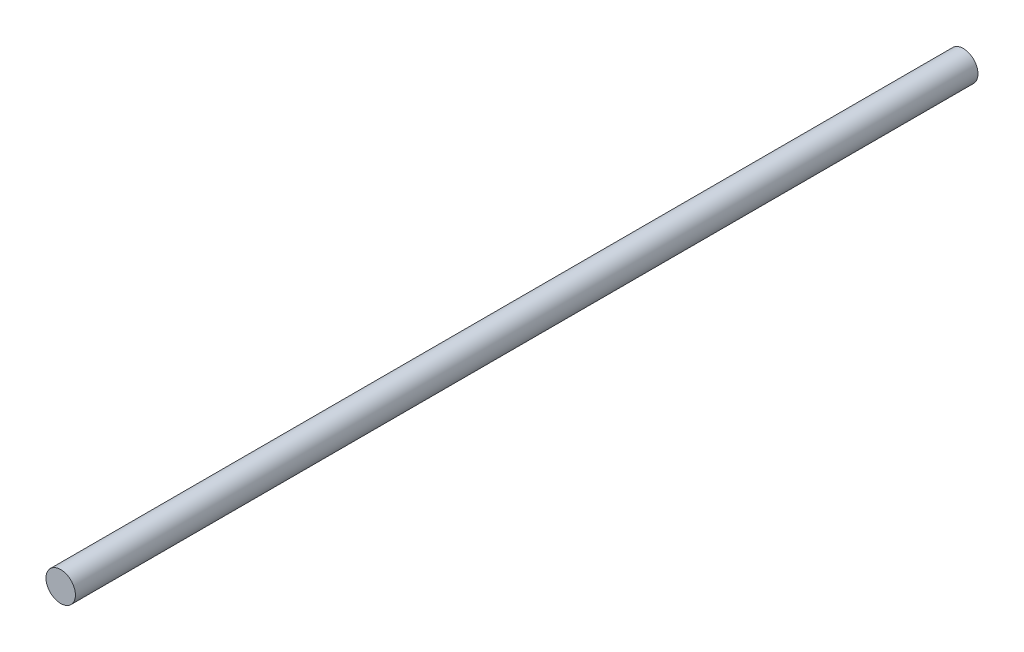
SolidWorks part; units mm, degrees
ref_plane "Front Plane" through (0, 0, 0) normal (0, 0, 1) x (1, 0, 0)
ref_plane "Top Plane" through (0, 0, 0) normal (0, 1, 0) x (1, 0, 0)
ref_plane "Right Plane" through (0, 0, 0) normal (1, 0, 0) x (0, 0, -1)
sketch "Sketch1" plane through (0, 0, 0) normal (0, 0, 1) x (1, 0, 0)
  circle A0 centre (0, 0) radius 2.8
  dimension "D1" = 5.6
extrude "Boss-Extrude1" add sketch "Sketch1" along normal blind 171.73
